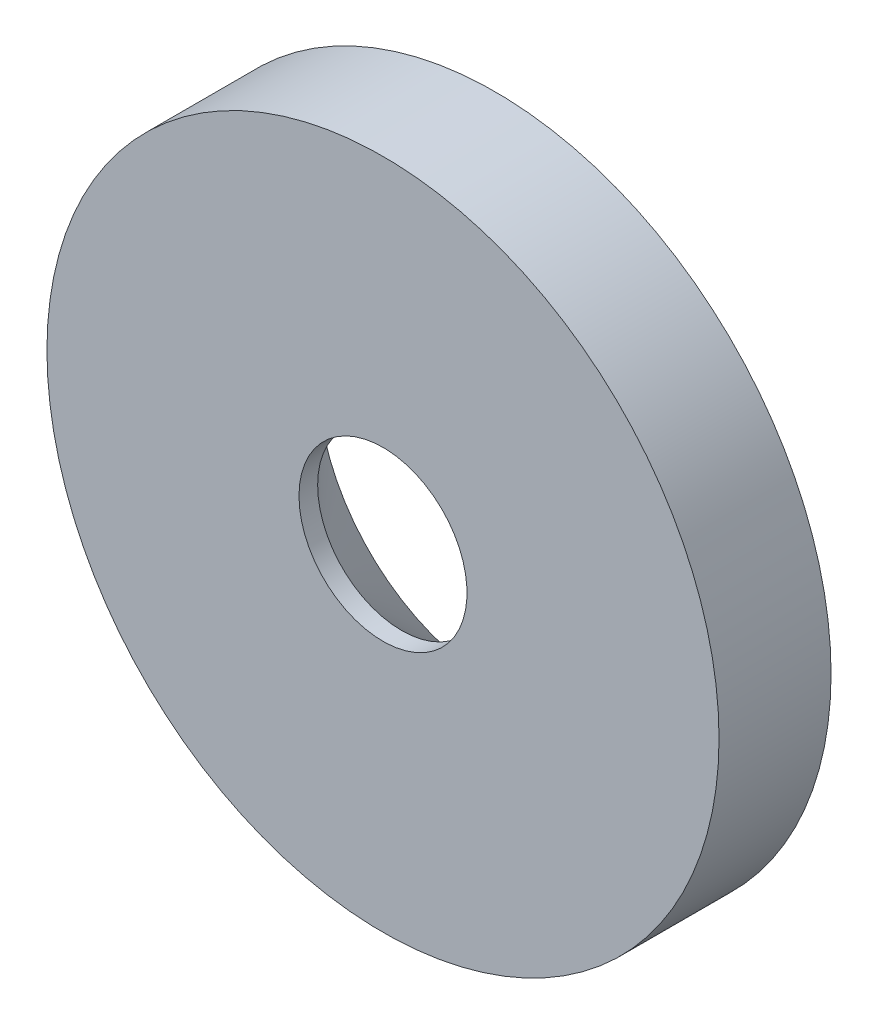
SolidWorks part; units mm, degrees
ref_plane "Plan de face" through (0, 0, 0) normal (0, 0, 1) x (1, 0, 0)
ref_plane "Plan de dessus" through (0, 0, 0) normal (0, 1, 0) x (1, 0, 0)
ref_plane "Plan de droite" through (0, 0, 0) normal (1, 0, 0) x (0, 0, -1)
sketch "Esquisse1" plane through (0, 0, 0) normal (0, 0, 1) x (1, 0, 0)
  circle A0 centre (0, 0) radius 9
  dimension "D1" = 18
extrude "Extrusion1" add sketch "Esquisse1" along normal blind 3
sketch "Esquisse2" plane through (0, 0, 0) normal (0, 0, -1) x (-1, 0, 0)
  circle A0 centre (0, 0) radius 2.25
  dimension "D1" = 4.5
extrude "Enlèv. mat.-Extru.1" cut sketch "Esquisse2" against normal through all
chamfer "Chanfrein1" distance 2.5 angle 45 1 edges at (-2.25, 0, 0)
